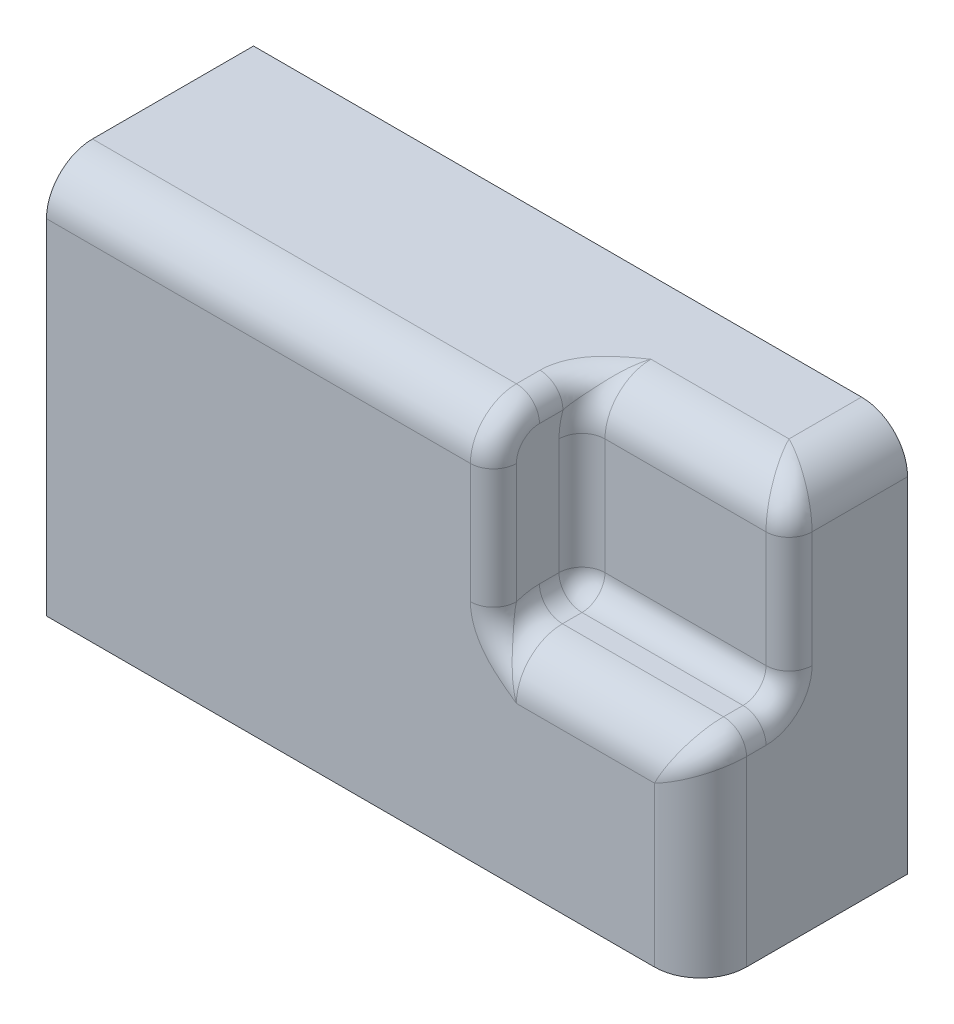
SolidWorks part; units mm, degrees
ref_plane "Front Plane" through (0, 0, 0) normal (0, 0, 1) x (1, 0, 0)
ref_plane "Top Plane" through (0, 0, 0) normal (0, 1, 0) x (1, 0, 0)
ref_plane "Right Plane" through (0, 0, 0) normal (1, 0, 0) x (0, 0, -1)
sketch "Sketch1" plane through (0, 0, 0) normal (0, 0, 1) x (1, 0, 0)
  line L1 (0, 0) -> (72.2061, 0)
  line L2 (0, 0) -> (0, 43.0703)
  line L3 (0, 43.0703) -> (72.2061, 43.0703)
  line L4 (72.2061, 0) -> (72.2061, 43.0703)
extrude "Boss-Extrude1" add sketch "Sketch1" along normal blind 22.86
sketch "Sketch2" plane through (72.2061, 0, 0) normal (1, 0, 0) x (0, 0, -1)
  line L1 (-22.86, 43.0703) -> (-13.0839, 43.0703)
  line L2 (-22.86, 43.0703) -> (-22.86, 22.6643)
  line L3 (-22.86, 22.6643) -> (-13.0839, 22.6643)
  line L4 (-13.0839, 43.0703) -> (-13.0839, 22.6643)
extrude "Cut-Extrude1" cut sketch "Sketch2" against normal blind 22.86
fillet "Fillet1" radius 5.08 5 edges at (60.7761, 43.0703, 13.0839) (60.7761, 22.6643, 22.86) (24.6731, 43.0703, 22.86) (72.2061, 11.3321, 22.86) (72.2061, 43.0703, 6.542)
fillet "Fillet2" radius 2.54 7 edges at (70.7182, 21.1764, 21.3721) (70.7182, 41.5824, 11.596) (49.3461, 43.0703, 12.892) (49.3461, 41.5824, 21.3721) (72.2061, 22.6643, 15.432) (72.2061, 30.3273, 13.0839) (49.3461, 27.7873, 22.86)
fillet "Fillet3" radius 2.54 8 edges at (71.4622, 21.9203, 12.34) (48.5145, 20.089, 22.1996) (49.3461, 22.4912, 19.0948) (48.5145, 42.4099, 10.5086) (49.3461, 39.3051, 12.9108) (59.5061, 22.6643, 13.0839) (49.3461, 22.6643, 15.432) (49.3461, 30.3273, 13.0839)
other "Fillet-Corner2"
other "Fillet-Corner3"
other "Fillet-Corner4"
